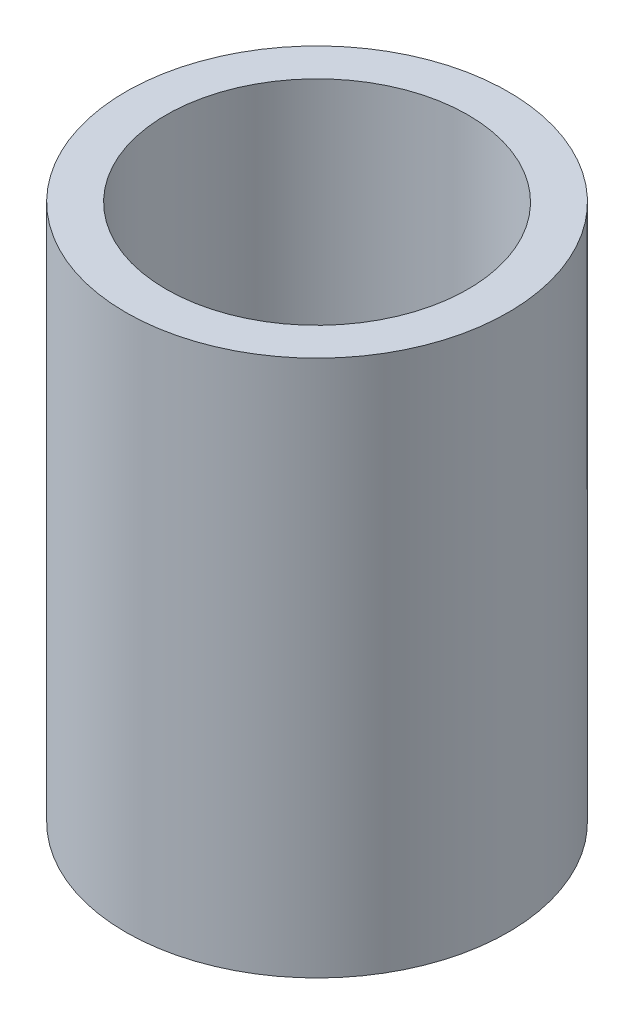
SolidWorks part; units mm, degrees
ref_plane "Front Plane" through (0, 0, 0) normal (0, 0, 1) x (1, 0, 0)
ref_plane "Top Plane" through (0, 0, 0) normal (0, 1, 0) x (1, 0, 0)
ref_plane "Right Plane" through (0, 0, 0) normal (1, 0, 0) x (0, 0, -1)
sketch "Sketch1" plane through (0, 0, 0) normal (0, 1, 0) x (1, 0, 0)
  circle A0 centre (0, 0) radius 1.4478
  circle A1 centre (0, 0) radius 1.143
  dimension "D1" = 2.286
  dimension "D2" = 2.8956
extrude "Boss-Extrude1" add sketch "Sketch1" along normal blind 4.064
